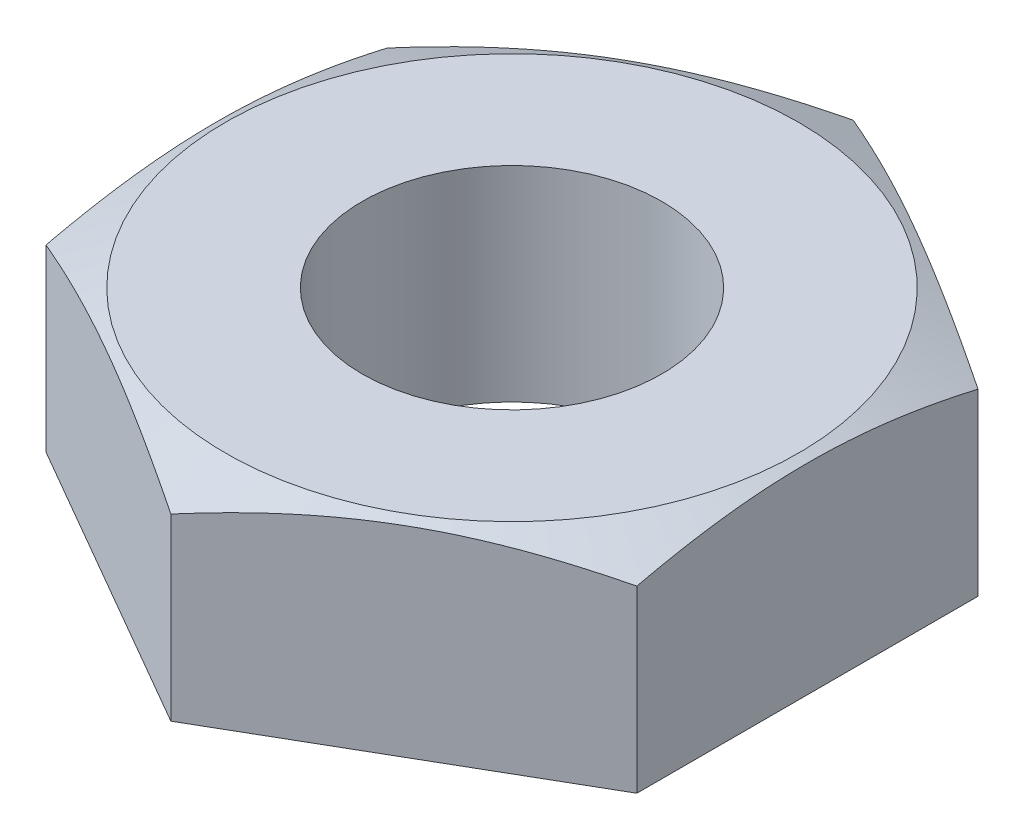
SolidWorks part; units mm, degrees
ref_plane "Front" through (0, 0, 0) normal (0, 0, 1) x (1, 0, 0)
ref_plane "Top" through (0, 0, 0) normal (0, 1, 0) x (1, 0, 0)
ref_plane "Right" through (0, 0, 0) normal (1, 0, 0) x (0, 0, -1)
sketch "Sketch1" plane through (0, 0, 0) normal (0, 0, 1) x (1, 0, 0)
  line L0 (0, -33.02) -> (0, 36.322) construction
  line L1 (2.413, 0) -> (2.413, 3.302)
  line L2 (2.413, 3.302) -> (4.6194, 3.302)
  line L3 (4.6194, 3.302) -> (5.4993, 2.8917)
  line L4 (5.4993, 2.8917) -> (5.4993, 0)
  line L5 (5.4993, 0) -> (4.2862, 0)
  line L6 (4.2862, 0) -> (2.413, 0)
  dimension "D1" = 10.9985
  dimension "D2" = 4.826
  dimension "D3" = 3.302
revolve "Base-Revolve" add sketch "Sketch1" angle 360 about L0
sketch "Sketch2" plane through (0, 0, 0) normal (0, 1, 0) x (1, 0, 0)
  line L0 (4.7625, 2.7496) -> (0, 5.4993)
  line L1 (0, 5.4993) -> (-4.7625, 2.7496)
  line L2 (-4.7625, 2.7496) -> (-4.7625, -2.7496)
  line L3 (-4.7625, -2.7496) -> (0, -5.4993)
  line L4 (0, -5.4993) -> (4.7625, -2.7496)
  line L5 (4.7625, -2.7496) -> (4.7625, 2.7496)
  line L6 (6.0492, 6.0492) -> (-6.0492, 6.0492)
  line L7 (-6.0492, 6.0492) -> (-6.0492, -6.0492)
  line L8 (-6.0492, -6.0492) -> (6.0492, -6.0492)
  line L9 (6.0492, -6.0492) -> (6.0492, 6.0492)
extrude "Cut-Extrude1" cut sketch "Sketch2" along normal blind 3.302
